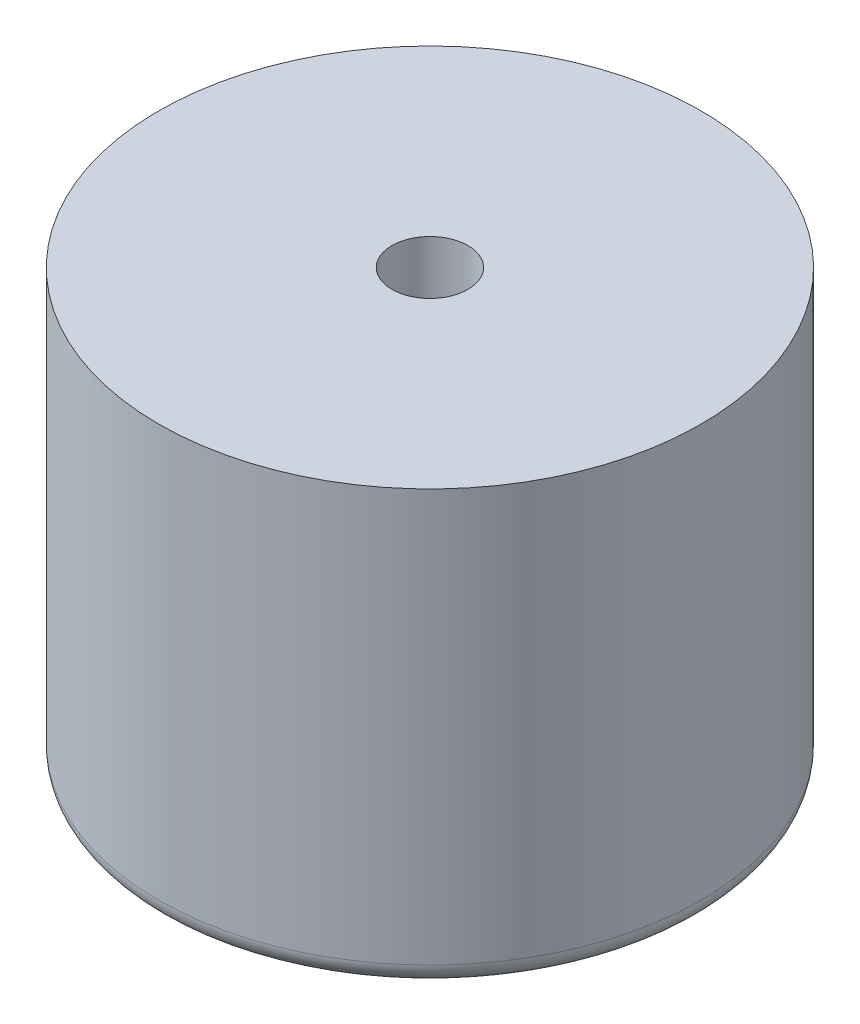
SolidWorks part; units mm, degrees
ref_plane "Спереди" through (0, 0, 0) normal (0, 0, 1) x (1, 0, 0)
ref_plane "Сверху" through (0, 0, 0) normal (0, 1, 0) x (1, 0, 0)
ref_plane "Справа" through (0, 0, 0) normal (1, 0, 0) x (0, 0, -1)
sketch "Эскиз1" plane through (0, 0, 0) normal (0, 1, 0) x (1, 0, 0)
  circle A0 centre (0, 0) radius 25
  dimension "D1" = 50
extrude "Бобышка-Вытянуть1" add sketch "Эскиз1" along normal blind 40
fillet "Скругление1" radius 2 1 edges at (0, 0, 25)
hole_wizard "Зенковка для винта с потайной головкой и внутренним шестигранником M61" positions "Эскиз2" profile "Эскиз3" countersink size "M6" standard "ISO"
sketch "Эскиз2" plane through (0, 0, 0) normal (0, -1, 0) x (-1, 0, 0)
  point P0 (0, 0)
sketch "Эскиз3" plane through (0, 0, 0) normal (1, 0, 0) x (0, 0, -1)
  line L0 (0, 0) -> (0, 40)
  line L1 (0, 40) -> (3.5, 40)
  line L2 (3.5, 40) -> (3.5, 5)
  line L3 (3.5, 5) -> (8.5, 0)
  line L5 (8.5, 0) -> (0, 0)
  line L6 (-3.5, 5) -> (-8.5, 0) construction
  line L11 (0, -6.35) -> (0, 107.95) construction
  dimension "Диаметр сквозного отверстия" = 7
  dimension "Глубина сквозного отверстия" = 40
  dimension "Диаметр передней зенковки" = 17
  dimension "Угол передней зенковки" = 90
